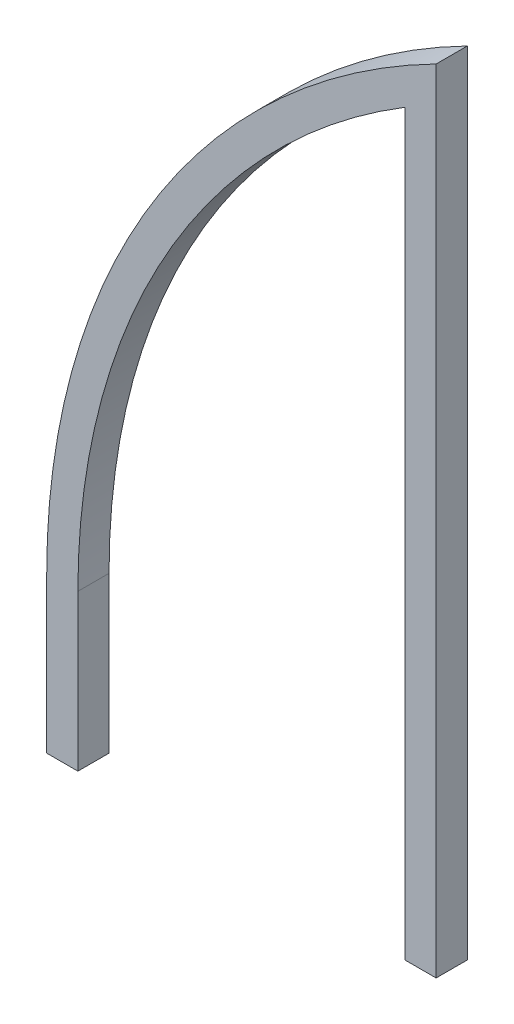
SolidWorks part; units mm, degrees
ref_plane "Alzado" through (0, 0, 0) normal (0, 0, 1) x (1, 0, 0)
ref_plane "Planta" through (0, 0, 0) normal (0, 1, 0) x (1, 0, 0)
ref_plane "Vista lateral" through (0, 0, 0) normal (1, 0, 0) x (0, 0, -1)
sketch "Croquis1" plane through (0, 0, 0) normal (0, 0, 1) x (1, 0, 0)
  line L0 (-481.7014, -491.3706) -> (-481.7014, 1541.4408)
  line L1 (-1481.7014, -491.3706) -> (-1401.7014, -491.3706)
  line L2 (-1481.7014, -491.3706) -> (-1481.7014, -91.3706)
  line L3 (-561.7014, -491.3706) -> (-561.7014, 1405.1257)
  line L4 (-481.7014, -491.3706) -> (-481.7014, -91.3706) construction
  line L5 (-561.7014, -491.3706) -> (-481.7014, -491.3706)
  line L6 (-1401.7014, -491.3706) -> (-1401.7014, -91.3706)
  line L7 (-561.7014, -411.3706) -> (-561.7014, 1405.1257) construction
  line L8 (-1401.7014, -411.3706) -> (-1401.7014, -91.3706) construction
  line L9 (-1401.7014, -411.3706) -> (-561.7014, -411.3706) construction
  line L11 (-1481.7014, -491.3706) -> (-481.7014, -491.3706) construction
  arc A0 (-1481.7014, -91.3706) -> (-481.7014, 1541.4408) centre (351.3351, -91.3706) cw
  arc A1 (-1401.7014, -91.3706) -> (-561.7014, 1405.1257) centre (351.3351, -91.3706) cw
  dimension "D2" = 80
  dimension "D1" = 1000
extrude "Saliente-Extruir1" add sketch "Croquis1" along normal blind 80
